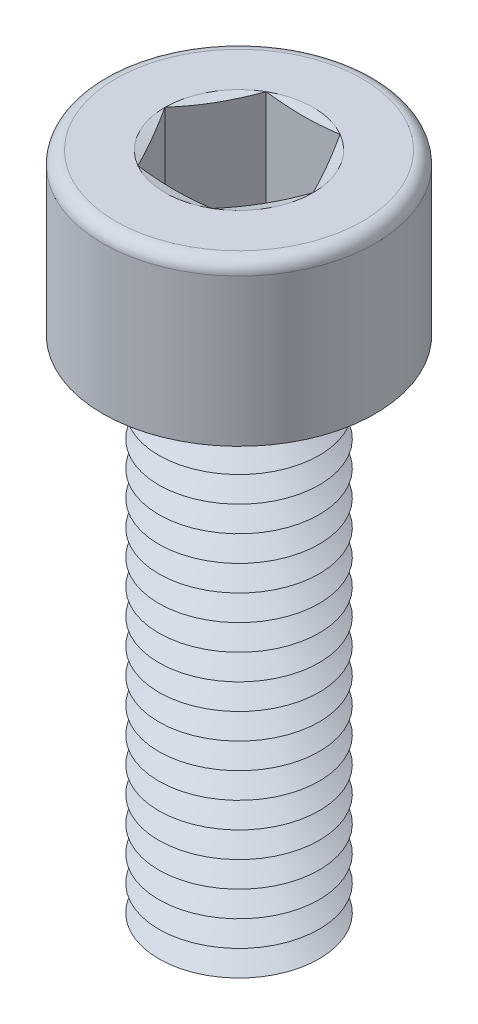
SolidWorks part; units mm, degrees
ref_plane "Front Plane" through (0, 0, 0) normal (0, 0, 1) x (1, 0, 0)
ref_plane "Top Plane" through (0, 0, 0) normal (0, 1, 0) x (1, 0, 0)
ref_plane "Right Plane" through (0, 0, 0) normal (1, 0, 0) x (0, 0, -1)
sketch "Sketch1" plane through (0, 0, 0) normal (0, 1, 0) x (1, 0, 0)
  circle A0 centre (0, 0) radius 2.5
  dimension "D1" = 5
extrude "Extrude1" add sketch "Sketch1" along normal blind 16
sketch "Sketch2" plane through (0, 16, 0) normal (0, 1, 0) x (1, 0, 0)
  circle A0 centre (0, 0) radius 4.25
  dimension "D1" = 8.5
extrude "Extrude2" add sketch "Sketch2" along normal blind 5
sketch "Sketch3" plane through (0, 21, 0) normal (0, 1, 0) x (1, 0, 0)
  line L1 (1.1547, 2) -> (-1.1547, 2)
  line L2 (-1.1547, 2) -> (-2.3094, 0)
  line L3 (-2.3094, 0) -> (-1.1547, -2)
  line L4 (-1.1547, -2) -> (1.1547, -2)
  line L5 (1.1547, -2) -> (2.3094, 0)
  line L6 (2.3094, 0) -> (1.1547, 2)
  circle A0 centre (0, 0) radius 2 construction
  dimension "D1" = 4
extrude "Extrude3" cut sketch "Sketch3" against normal blind 4
fillet "Fillet1" radius 0.4 1 edges at (0, 21, 4.25)
sketch "Sketch4" plane through (0, 0, 0) normal (1, 0, 0) x (0, 0, -1)
  line L0 (-2, 17) -> (0, 17)
  line L1 (0, 17) -> (0, 15.8453)
  line L2 (0, 15.8453) -> (-2, 17)
  dimension "D1" = 30
revolve "Cut-Revolve1" cut sketch "Sketch4" angle 360 about L1
sketch "Sketch5" plane through (0, 0, 0) normal (0, 0, 1) x (1, 0, 0)
  line L0 (-2.5, 0.4) -> (-2.5, -0.4)
  line L1 (-2.5, 16) -> (-2.5, 0) construction
  line L2 (-2.5, -0.4) -> (-1.8072, 0)
  line L3 (-2.5, 0) -> (2.5, 0) construction
  line L4 (-1.8072, 0) -> (-2.5, 0.4)
  dimension "D1" = 0.8
revolve "Cut-Revolve2" cut sketch "Sketch5" angle 360 about axis through (0, 16, 0) along (0, -1, 0)
pattern_linear "LPattern1" count 20 spacing 0.8 along (0, 1, 0) of "Cut-Revolve2"
sketch "Sketch6" plane through (0, 21, 0) normal (0, 1, 0) x (1, 0, 0)
  circle A0 centre (0, 0) radius 2.3094
extrude "Extrude4" cut sketch "Sketch6" against normal through all draft 75
